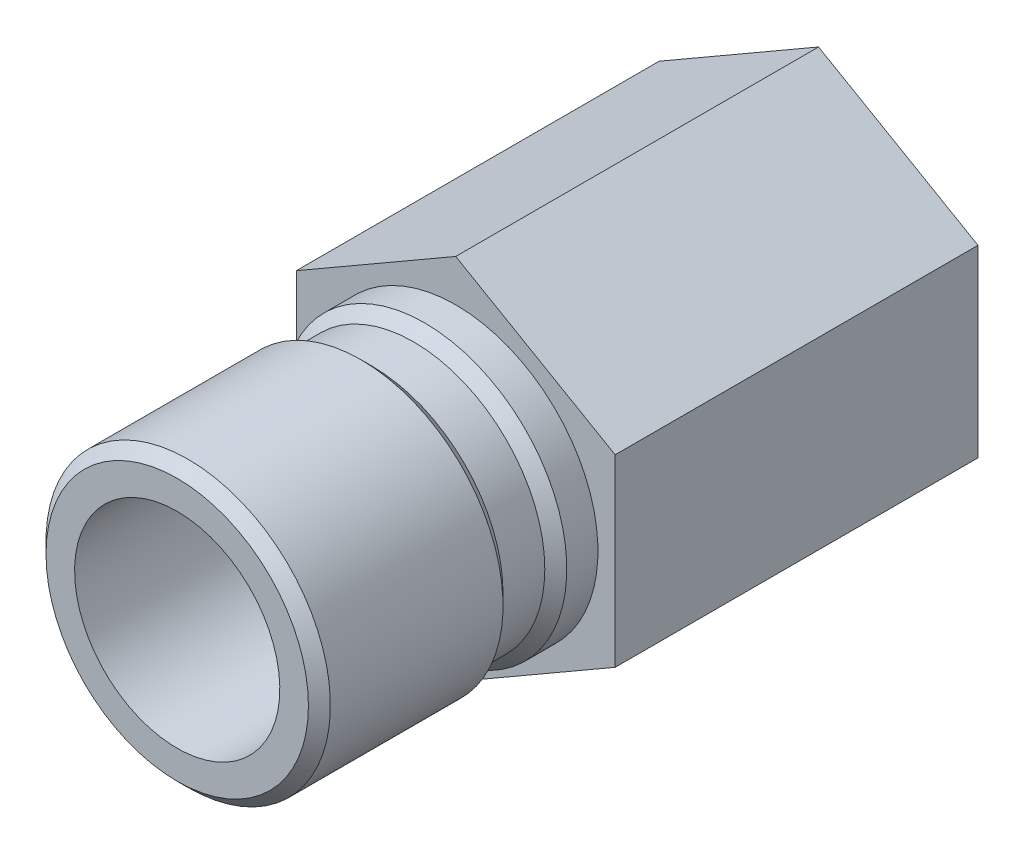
SolidWorks part; units mm, degrees
ref_plane "Front Plane" through (0, 0, 0) normal (0, 0, 1) x (1, 0, 0)
ref_plane "Top Plane" through (0, 0, 0) normal (0, 1, 0) x (1, 0, 0)
ref_plane "Right Plane" through (0, 0, 0) normal (1, 0, 0) x (0, 0, -1)
sketch "Sketch1" plane through (0, 0, 0) normal (1, 0, 0) x (0, 0, -1)
  line L0 (0, 0) -> (-22.479, 0) construction
  line L1 (-19.304, 7.112) -> (-19.304, 9.0932)
  line L2 (-5.8166, 9.0932) -> (-5.8166, 0) construction
  line L3 (-18.542, 9.8552) -> (-6.5786, 9.8552)
  line L4 (0, 12.7584) -> (0, 0) construction
  line L5 (-5.8166, 9.0932) -> (-2.921, 9.0932)
  line L6 (-2.159, 9.8552) -> (0, 9.8552)
  line L7 (0, 9.8552) -> (0, 12.7584)
  line L8 (-5.8166, 9.0932) -> (-6.5786, 9.8552)
  line L9 (-2.921, 9.0932) -> (-2.159, 9.8552)
  line L10 (-19.304, 9.0932) -> (-18.542, 9.8552)
  line L11 (-19.304, 7.112) -> (8.9397, 7.112)
  line L12 (0, 12.7584) -> (25.146, 12.7584)
  line L14 (25.146, 12.7584) -> (25.146, 9.4056)
  line L15 (9.906, 8.9294) -> (25.146, 9.4056)
  line L16 (8.9397, 7.112) -> (9.906, 8.9294)
  dimension "D1" = 19.304
  dimension "D2" = 2.8956
  dimension "D3" = 0.762
  dimension "D4" = 45
  dimension "D5" = 13.4874
  dimension "D6" = 45
  dimension "D7" = 25.5168
  dimension "D8" = 118
  dimension "D9" = 44.45
  dimension "D10" = 3.175
  dimension "D11" = 17.8587
  dimension "D12" = 14.224
  dimension "D13" = 1.79
  dimension "D14" = 19.7104
  dimension "D15" = 15.24
revolve "Revolve1" add sketch "Sketch1" angle 360 about L0
sketch "Sketch2" plane through (0, 0, 0) normal (0, 0, 1) x (1, 0, 0)
  line L1 (-11.049, 6.3791) -> (-11.049, -6.3791)
  line L2 (-11.049, -6.3791) -> (0, -12.7583)
  line L3 (0, -12.7583) -> (11.049, -6.3791)
  line L4 (11.049, -6.3791) -> (11.049, 6.3791)
  line L5 (11.049, 6.3791) -> (0, 12.7583)
  line L6 (0, 12.7583) -> (-11.049, 6.3791)
  circle A0 centre (0, 0) radius 11.049 construction
  dimension "D1" = 22.098
extrude "Cut-Extrude1" cut sketch "Sketch2" against normal through all flip side to cut
